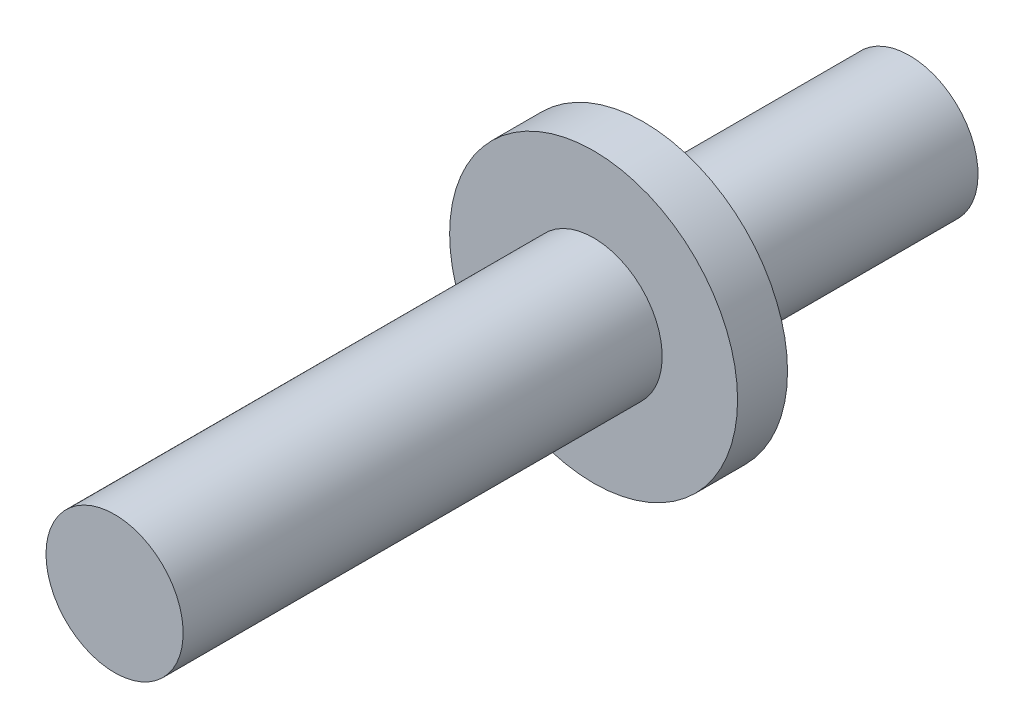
SolidWorks part; units mm, degrees
ref_plane "Front Plane" through (0, 0, 0) normal (0, 0, 1) x (1, 0, 0)
ref_plane "Top Plane" through (0, 0, 0) normal (0, 1, 0) x (1, 0, 0)
ref_plane "Right Plane" through (0, 0, 0) normal (1, 0, 0) x (0, 0, -1)
sketch "Sketch2" plane through (0, 0, 0) normal (0, 0, -1) x (-1, 0, 0)
  circle A0 centre (0, 0) radius 4.7625
extrude "Extrude1" add sketch "Sketch2" against normal blind 33.2731
sketch "Sketch3" plane through (0, 0, 0) normal (0, 0, -1) x (-1, 0, 0)
  circle A0 centre (0, 0) radius 10
extrude "Extrude2" add sketch "Sketch3" along normal blind 3.4694
sketch "Sketch4" plane through (0, 0, -3.4694) normal (0, 0, -1) x (-1, 0, 0)
  circle A0 centre (0, 0) radius 4.7625
extrude "Extrude3" add sketch "Sketch4" along normal blind 18.4694
